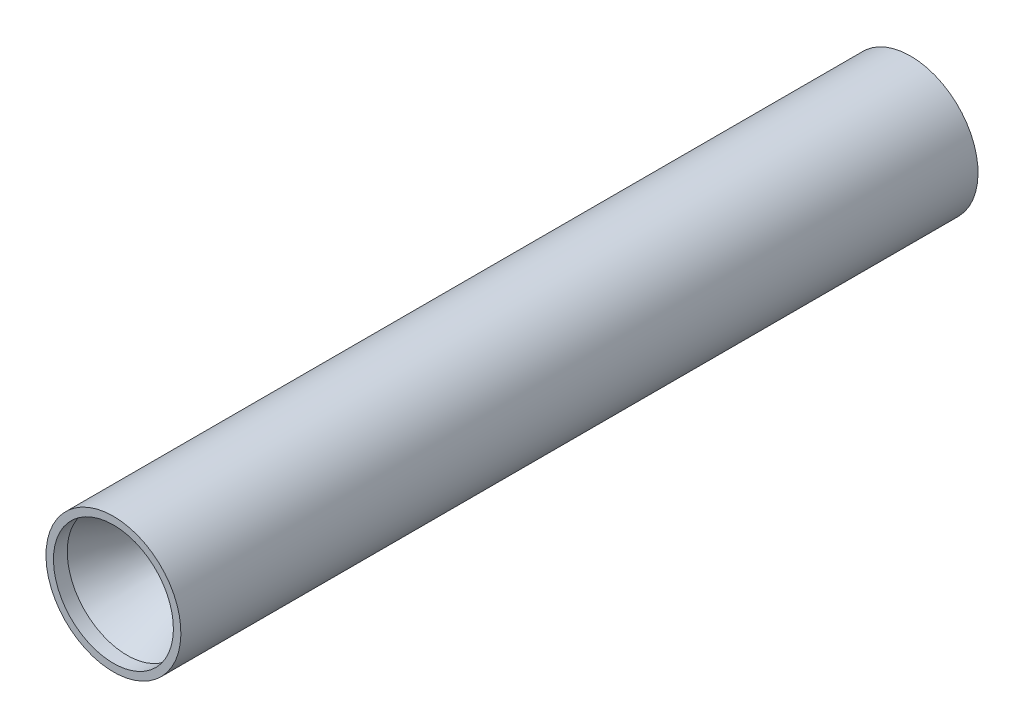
SolidWorks part; units mm, degrees
ref_plane "Front Plane" through (0, 0, 0) normal (0, 0, 1) x (1, 0, 0)
ref_plane "Top Plane" through (0, 0, 0) normal (0, 1, 0) x (1, 0, 0)
ref_plane "Right Plane" through (0, 0, 0) normal (1, 0, 0) x (0, 0, -1)
sketch "Sketch1" plane through (0, 0, 0) normal (1, 0, 0) x (0, 0, -1)
  line L0 (-289.5, 49) -> (289.5, 49)
  line L1 (289.5, 49) -> (289.5, 10)
  line L2 (289.5, 10) -> (279.5, 10)
  line L3 (279.5, 10) -> (279.5, 0)
  line L4 (279.5, 0) -> (264.5, 0)
  line L5 (264.5, 0) -> (264.5, 35.25)
  line L6 (264.5, 35.25) -> (-169.5, 35.25)
  line L7 (-169.5, 35.25) -> (-169.5, 39)
  line L8 (-169.5, 39) -> (-179.5, 39)
  line L9 (-179.5, 39) -> (-204.5, 14)
  line L10 (-219.5, 15.5766) -> (-204.5, 14)
  line L11 (-219.5, 15.5766) -> (-279.5, 43.555)
  line L12 (-279.5, 43.555) -> (-289.5, 43.555)
  line L13 (-289.5, 43.555) -> (-289.5, 49)
  line L14 (279.5, 0) -> (-433.5179, 0) construction
  point P7 (272, 0)
  dimension "D1" = 579
  dimension "D2" = 49
  dimension "D3" = 10
  dimension "D4" = 6
  dimension "D5" = 25
  dimension "D6" = 60
  dimension "D7" = 25
  dimension "D8" = 10
  dimension "D9" = 135
  dimension "D10" = 35
  dimension "D11" = 10
  dimension "D12" = 13.75
  dimension "D13" = 35
  dimension "D14" = 15
  dimension "D15" = 10
  dimension "D16" = 289.5
revolve "Revolve1" add sketch "Sketch1" angle 360 about L14
